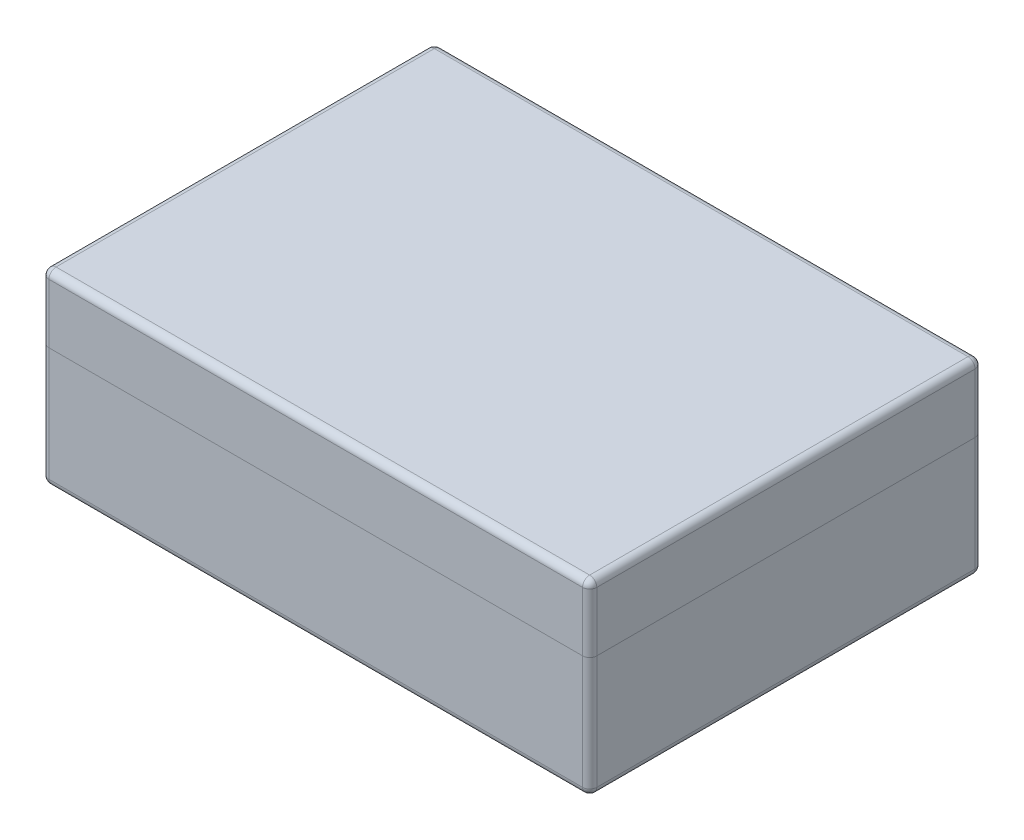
SolidWorks part; units mm, degrees
ref_plane "Front" through (0, 0, 0) normal (0, 0, 1) x (1, 0, 0)
ref_plane "Top" through (0, 0, 0) normal (0, 1, 0) x (1, 0, 0)
ref_plane "Right" through (0, 0, 0) normal (1, 0, 0) x (0, 0, -1)
sketch "Sketch1" plane through (0, 0, 0) normal (0, 1, 0) x (1, 0, 0)
  line L0 (-231, -165.5) -> (231, 165.5) construction
  line L1 (-231, -165.5) -> (231, -165.5)
  line L2 (-231, -165.5) -> (-231, 165.5)
  line L3 (-231, 165.5) -> (231, 165.5)
  line L4 (231, -165.5) -> (231, 165.5)
  dimension "D1" = 462
  dimension "D2" = 331
extrude "Boss-Extrude1" add sketch "Sketch1" along normal blind 158
sketch "hinge offset sketch" plane through (0, 0, 165.5) normal (0, 0, 1) x (1, 0, 0)
  line L0 (-231, 102) -> (231, 102) construction
  line L1 (-231, 158) -> (-231, 0) construction
  line L2 (231, 158) -> (231, 0) construction
  line L3 (-231, 0) -> (231, 0) construction
  dimension "D1" = 102
ref_plane "hinging plane" through (0, 102, 0) normal (0, 1, 0) x (1, 0, 0)
fillet "outside corners" radius 6 12 edges at (0, 0, -165.5) (-231, 79, -165.5) (-231, 0, 0) (-231, 79, 165.5) (0, 0, 165.5) (231, 79, 165.5) (231, 79, -165.5) (231, 0, 0) (0, 158, -165.5) (231, 158, 0) (0, 158, 165.5) (-231, 158, 0)
sketch "Sketch2" plane through (0, 102, 0) normal (0, 1, 0) x (1, 0, 0)
  line L1 (221, 155.5) -> (-221, 155.5)
  line L2 (221, 155.5) -> (221, -155.5)
  line L3 (221, -155.5) -> (-221, -155.5)
  line L4 (-221, 155.5) -> (-221, -155.5)
  line L5 (0, 0) -> (0, -413.3912) construction
  line L7 (-225, 165.5) -> (225, 165.5) construction
  dimension "D1" = 442
  dimension "D2" = 311
  dimension "D3" = 10
extrude "interior volume" cut sketch "Sketch2" against normal blind 94 and the other way blind 45
split "top bottom split" trim tools "hinging plane" bodies to split 104 resulting bodies 102 103
